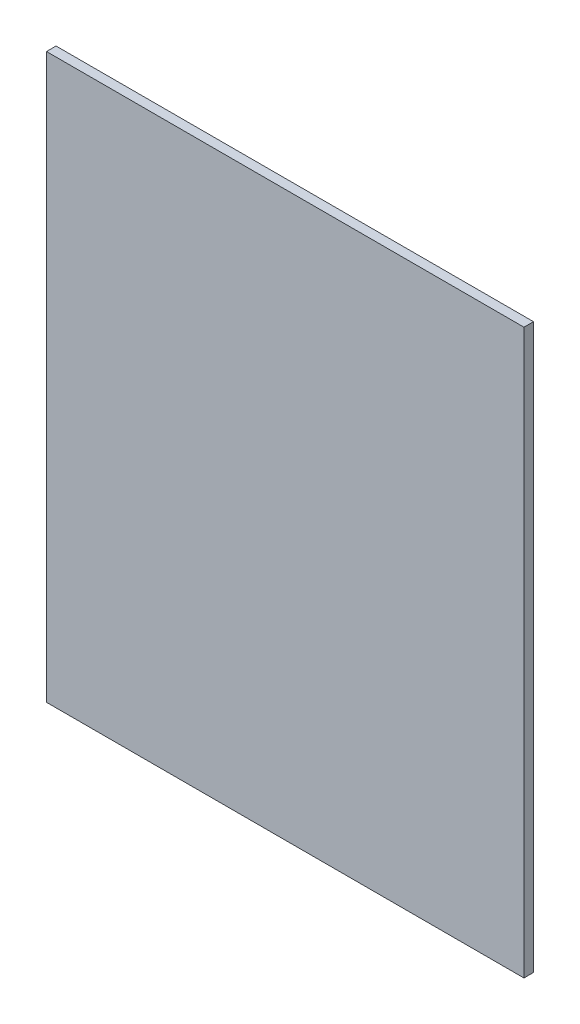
SolidWorks part; units mm, degrees
ref_plane "Alzado" through (0, 0, 0) normal (0, 0, 1) x (1, 0, 0)
ref_plane "Planta" through (0, 0, 0) normal (0, 1, 0) x (1, 0, 0)
ref_plane "Vista lateral" through (0, 0, 0) normal (1, 0, 0) x (0, 0, -1)
sketch "Croquis1" plane through (510, 0, 0) normal (-1, 0, 0) x (0, 0, 1)
  line L0 (-10, 590.2138) -> (0, 590.2138)
  line L1 (-10, 590.2138) -> (-10, 0)
  line L2 (0, 590.2138) -> (0, 0)
  line L3 (-10, 0) -> (0, 0)
  point P0 (-10, 587.2165)
  point P8 (-10.5435, 583.2526)
  point P9 (0, 0)
  point P10 (0, 600)
  point P11 (-10, 587.2165)
  point P12 (0, 0)
  point P13 (-10, 600)
  point P14 (-10, 600)
  point P15 (-10, 600)
  dimension "D1" = 10
extrude "Saliente-Extruir1" add sketch "Croquis1" along normal up to surface (500 mm away)
